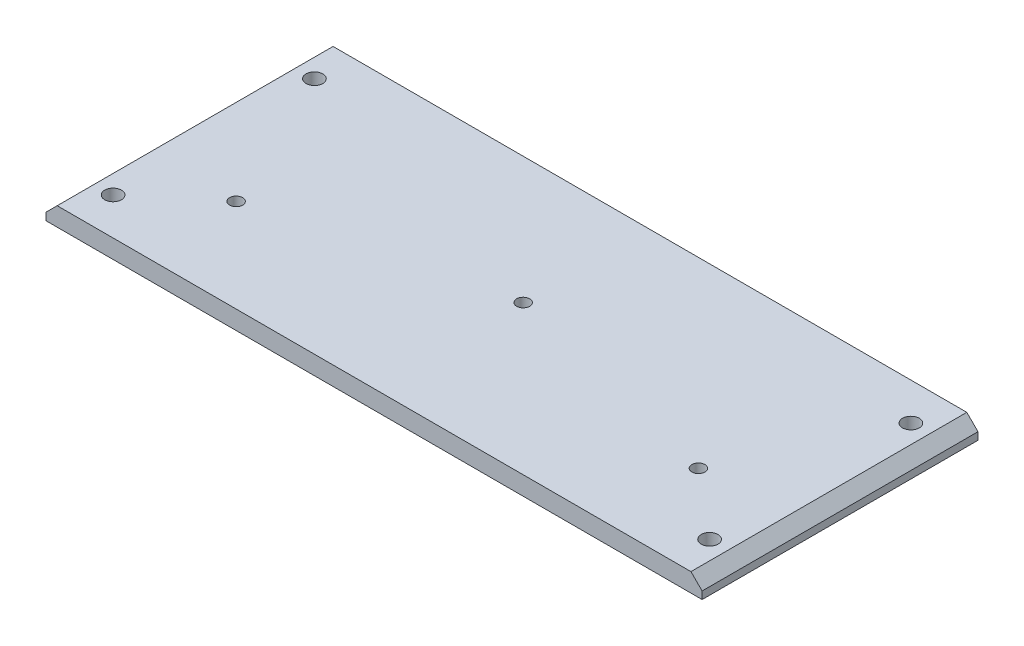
SolidWorks part; units mm, degrees
ref_plane "Front" through (0, 0, 0) normal (0, 0, 1) x (1, 0, 0)
ref_plane "Top" through (0, 0, 0) normal (0, 1, 0) x (1, 0, 0)
ref_plane "Right" through (0, 0, 0) normal (1, 0, 0) x (0, 0, -1)
sketch "Sketch1" plane through (0, 0, 0) normal (0, 1, 0) x (1, 0, 0)
  line L1 (0, 0) -> (176, 0)
  line L2 (0, 0) -> (0, 74)
  line L3 (0, 74) -> (176, 74)
  line L4 (176, 0) -> (176, 74)
  circle A0 centre (8, 10) radius 2.25
  circle A1 centre (8, 64) radius 2.25
  circle A2 centre (168, 64) radius 2.25
  circle A3 centre (168, 10) radius 2.25
  circle A4 centre (88, 40) radius 1.75
  circle A5 centre (26, 25) radius 1.75
  circle A6 centre (150, 25) radius 1.75
extrude "Extrude1" add sketch "Sketch1" along normal blind 5
chamfer "Chamfer1" distance 3 angle 45 2 edges at (0, 5, -37) (176, 5, -37)
